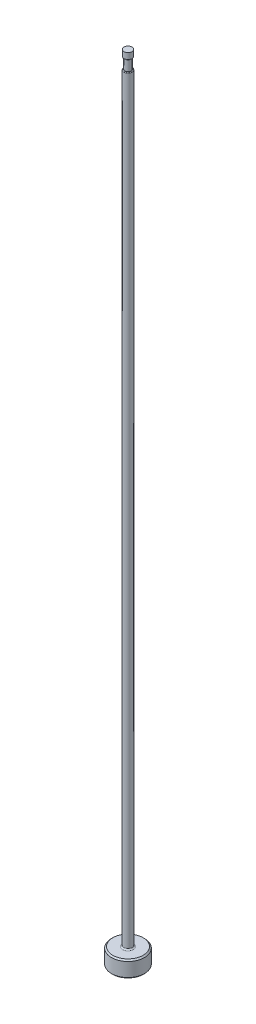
SolidWorks part; units mm, degrees
ref_plane "Front Plane" through (0, 0, 0) normal (0, 0, 1) x (1, 0, 0)
ref_plane "Top Plane" through (0, 0, 0) normal (0, 1, 0) x (1, 0, 0)
ref_plane "Right Plane" through (0, 0, 0) normal (1, 0, 0) x (0, 0, -1)
other "Configuration Table"
sketch "Sketch1" plane through (0, 0, 0) normal (0, 0, 1) x (1, 0, 0)
  line L0 (0, 259.9588) -> (0, -15.1925) construction
  line L1 (0, 0) -> (-3.175, 0)
  line L2 (-3.175, 0) -> (-3.175, 3.175)
  line L3 (-3.175, 3.175) -> (-0.7937, 3.175)
  line L4 (-0.7937, 3.175) -> (-0.7937, 152.4)
  line L5 (-0.7937, 152.4) -> (0, 152.4)
  line L6 (0, 152.4) -> (0, 0)
  dimension "L" = 152.4
  dimension "H" = 6.35
  dimension "T" = 3.175
  dimension "D" = 1.5875
revolve "Revolve1" add sketch "Sketch1" angle 360 about L0
chamfer "Chamfer1" distance 0.254 angle 45 2 edges at (0, 3.175, 3.175) (0, 0, 3.175)
fillet "Fillet1" radius 0.254 1 edges at (0, 3.175, 0.7937)
sketch "Sketch2" plane through (0, 0, 0) normal (0, 0, 1) x (1, 0, 0)
  line L0 (-0.7937, 152.4) -> (-0.7937, 3.429) construction
  line L1 (-0.7937, 151.13) -> (-0.5905, 151.13)
  line L2 (-0.7937, 151.13) -> (-0.7937, 149.098)
  line L3 (-0.7937, 149.098) -> (-0.5905, 149.098)
  line L4 (-0.5905, 151.13) -> (-0.5905, 149.098)
  line L5 (0.7937, 152.4) -> (-0.7937, 152.4) construction
  line L6 (0, 153.4483) -> (0, 147.3282) construction
  dimension "D1" = 2.032
  dimension "N" = 1.27
  dimension "FD" = 0.2032
  dimension "D3" = 1.1811
revolve "Vent Relief" cut sketch "Sketch2" angle 360 about L6
sketch "Sketch3" plane through (0, 0, 0) normal (0, 0, 1) x (1, 0, 0)
  line L0 (-0.5905, 150.114) -> (-0.5905, 86.614)
  line L1 (-0.5905, 151.13) -> (-0.5905, 149.098) construction
  line L2 (-0.7937, 149.098) -> (-0.7937, 3.429) construction
  line L3 (-0.7937, 85.4964) -> (-0.7937, 150.114)
  line L4 (-0.7937, 150.114) -> (-0.5905, 150.114)
  arc A0 (-0.5905, 86.614) -> (-0.7937, 85.4964) centre (-3.7655, 86.614) cw
  dimension "D1" = 3.175
  dimension "D2" = 63.5
extrude "D-Slot" cut sketch "Sketch3" against normal through all both and the other way through all
sketch "Sketch5" plane through (0, 0, 0) normal (0, 0, 1) x (1, 0, 0)
  line L0 (-0.7937, 151.13) -> (0.7937, 151.13) construction
  line L1 (-0.7937, 152.4) -> (-0.7747, 152.4)
  line L2 (-0.7937, 152.4) -> (-0.7937, 151.13)
  line L3 (-0.7937, 151.13) -> (-0.7747, 151.13)
  line L4 (-0.7747, 152.4) -> (-0.7747, 151.13)
  line L5 (0, 152.6877) -> (0, 150.5771) construction
  dimension "VP" = 0.019
revolve "Vent Diameter" cut sketch "Sketch5" angle 360 about L5
fillet "Fillet2" radius 0.127 2 edges at (0.7937, 149.098, 0) (0, 151.13, 0.7747)
sketch "Pocket Sketch" plane through (0, 0, 0) normal (0, 0, 1) x (1, 0, 0)
  line L0 (-3.5719, 0) -> (-3.5719, 3.2004)
  line L1 (-3.5719, 3.2004) -> (-1.7542, 3.2004)
  line L2 (-0.9922, 3.9624) -> (-0.9922, 22.225)
  line L3 (-0.9922, 22.225) -> (0, 22.225)
  line L4 (0, 22.225) -> (0, 0)
  line L5 (0, 0) -> (-3.5719, 0)
  line L6 (0, 12.6104) -> (0, -2.4989) construction
  line L7 (-3.175, 2.921) -> (-3.175, 0.254) construction
  line L8 (2.921, 3.175) -> (-2.921, 3.175) construction
  line L9 (-0.7937, 85.4964) -> (-0.7937, 3.429) construction
  line L10 (-1.7542, 3.2004) -> (-0.9922, 3.9624)
  point P3 (-0.9922, 3.2004)
  dimension "D1" = 7.1437
  dimension "D2" = 0.3969
  dimension "D3" = 0.0254
  dimension "D4" = 0.1984
  dimension "D5" = 1.9844
  dimension "D6" = 22.225
